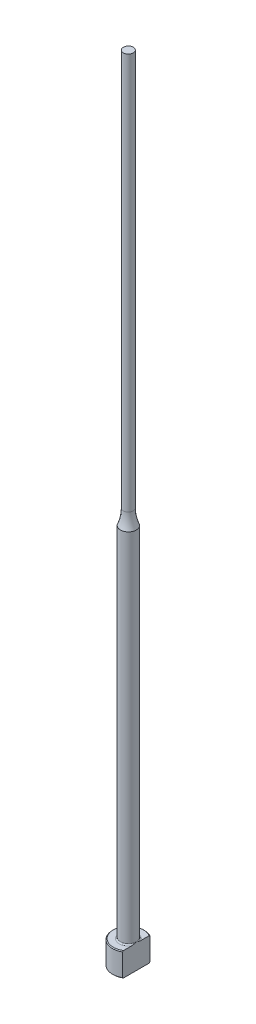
SolidWorks part; units mm, degrees
ref_plane "Front Plane" through (0, 0, 0) normal (0, 0, 1) x (1, 0, 0)
ref_plane "Top Plane" through (0, 0, 0) normal (0, 1, 0) x (1, 0, 0)
ref_plane "Right Plane" through (0, 0, 0) normal (1, 0, 0) x (0, 0, -1)
sketch "Sketch1" plane through (0, 0, 0) normal (0, 0, 1) x (1, 0, 0)
  line L0 (0, 259.9588) -> (0, -15.1925) construction
  line L1 (0, 0) -> (-4, 0)
  line L2 (-4, 0) -> (-4, 6)
  line L3 (-4, 6) -> (-2, 6)
  line L4 (-1.25, 100) -> (-1.25, 200)
  line L5 (-1.25, 200) -> (0, 200)
  line L6 (0, 200) -> (0, 0)
  line L7 (-2, 6) -> (-2, 96.2003)
  arc A0 (-2, 96.2003) -> (-1.25, 100) centre (-11.25, 100) ccw
  point P13 (-2, 0)
  dimension "D1" = 10
  dimension "L" = 200
  dimension "H" = 8
  dimension "T" = 6
  dimension "D" = 2.5
  dimension "B" = 4
  dimension "S" = 100
revolve "Revolve1" add sketch "Sketch1" angle 360 about L0
chamfer "Chamfer1" distance 0.2 angle 45 2 edges at (0, 6, 4) (0, 0, 4)
fillet "Fillet1" radius 0.3 1 edges at (0, 6, 2)
sketch "Sketch2" plane through (0, 0, 0) normal (0, 1, 0) x (1, 0, 0)
  line L0 (2, -3.4641) -> (2, 3.4641)
  circle A0 centre (0, 0) radius 4 construction
  arc A1 (2, -3.4641) -> (2, 3.4641) centre (0, 0) ccw
  circle A2 centre (0, 0) radius 2 construction
extrude "Keyed Head" cut sketch "Sketch2" along normal through all
